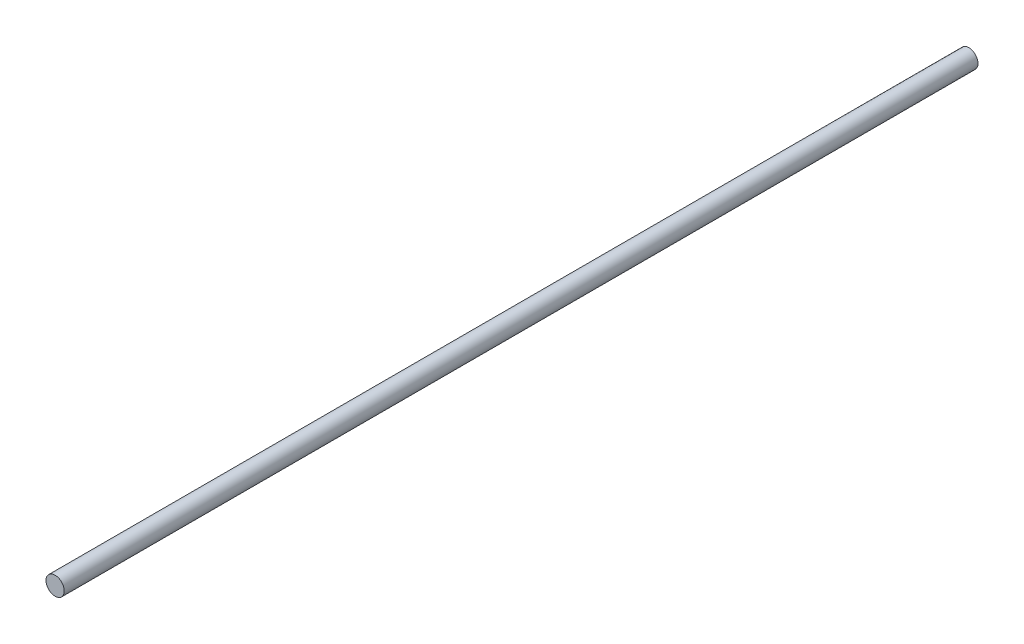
SolidWorks part; units mm, degrees
ref_plane "Plan de face" through (0, 0, 0) normal (0, 0, 1) x (1, 0, 0)
ref_plane "Plan de dessus" through (0, 0, 0) normal (0, 1, 0) x (1, 0, 0)
ref_plane "Plan de droite" through (0, 0, 0) normal (1, 0, 0) x (0, 0, -1)
sketch "Esquisse1" plane through (0, 0, 0) normal (0, 0, 1) x (1, 0, 0)
  circle A0 centre (0, 0) radius 2
extrude "Extrusion1" add sketch "Esquisse1" along normal blind 200
